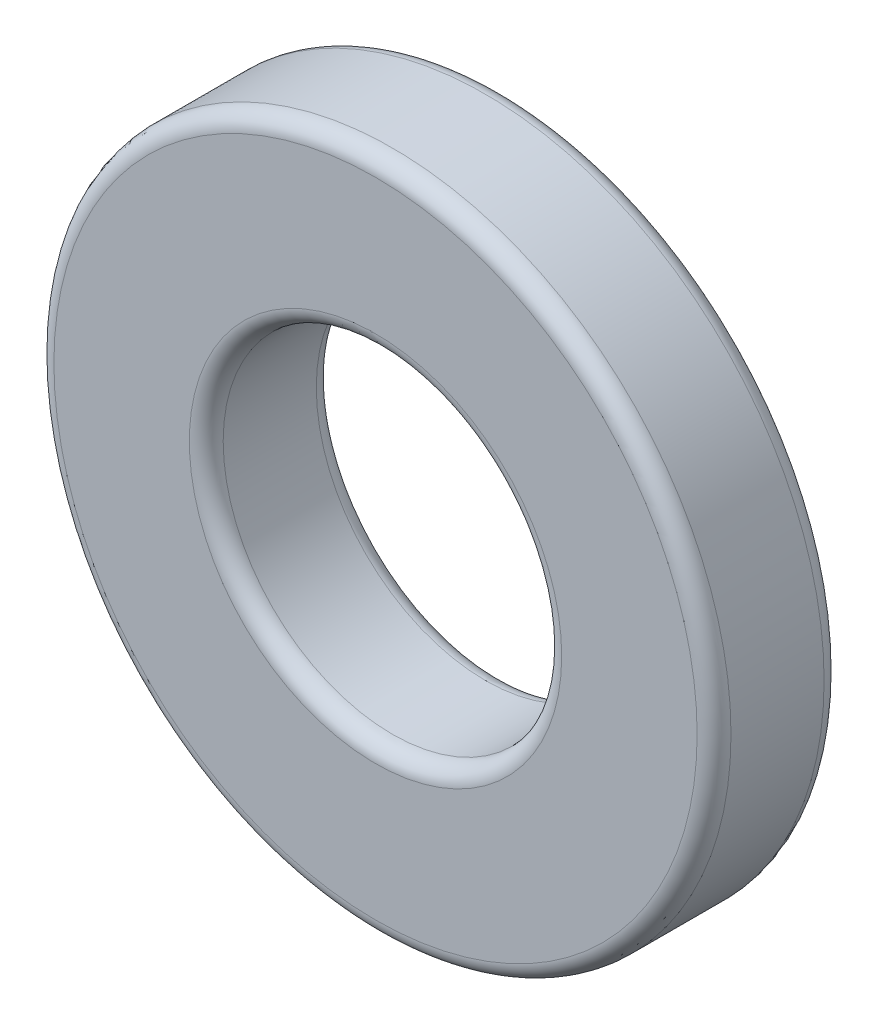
SolidWorks part; units mm, degrees
ref_plane "Plan de face" through (0, 0, 0) normal (0, 0, 1) x (1, 0, 0)
ref_plane "Plan de dessus" through (0, 0, 0) normal (0, 1, 0) x (1, 0, 0)
ref_plane "Plan de droite" through (0, 0, 0) normal (1, 0, 0) x (0, 0, -1)
sketch "Esquisse1" plane through (0, 0, 0) normal (0, 0, 1) x (1, 0, 0)
  circle A0 centre (0, 0) radius 2
  circle A3 centre (0, 0) radius 4
  dimension "D1" = 8
  dimension "D2" = 4
extrude "Boss.-Extru.1" add sketch "Esquisse1" along normal blind 1.5
fillet "Congé3" radius 0.2 4 edges at (2, 0, 0) (2, 0, 1.5) (4, 0, 0) (4, 0, 1.5)
